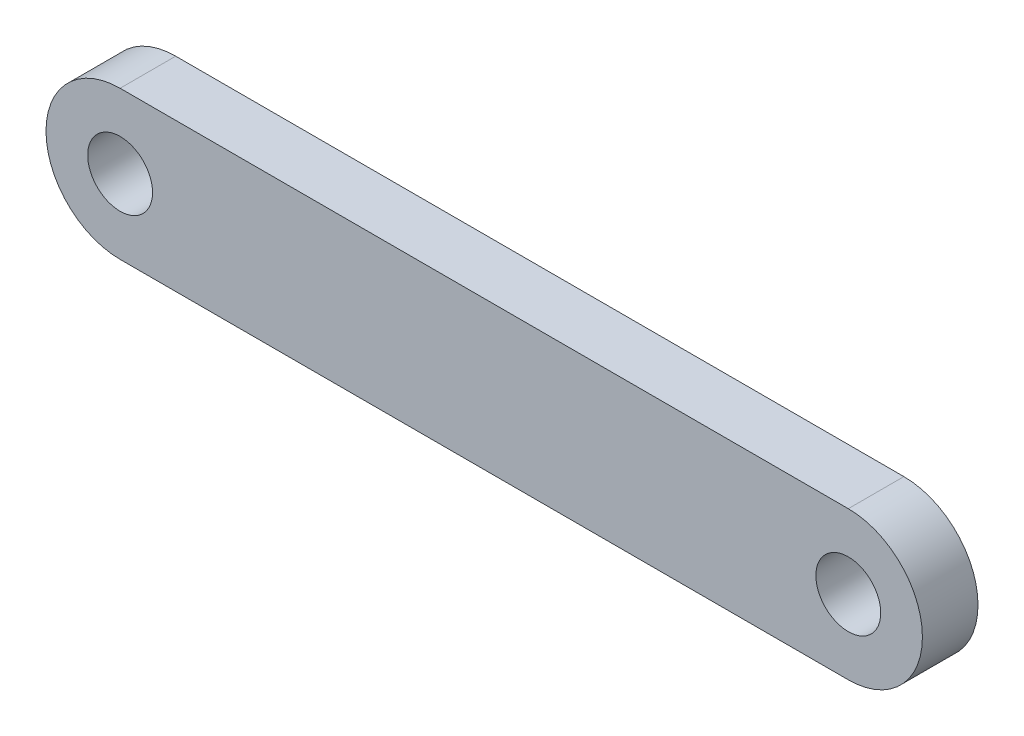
SolidWorks part; units mm, degrees
ref_plane "Plan de face" through (0, 0, 0) normal (0, 0, 1) x (1, 0, 0)
ref_plane "Plan de dessus" through (0, 0, 0) normal (0, 1, 0) x (1, 0, 0)
ref_plane "Plan de droite" through (0, 0, 0) normal (1, 0, 0) x (0, 0, -1)
sketch "Esquisse1" plane through (0, 0, 0) normal (0, 0, 1) x (1, 0, 0)
  line L0 (0, 0) -> (-39.3, 0)
  line L1 (-39.3, 4) -> (0, 4)
  line L2 (-39.3, -4) -> (0, -4)
  circle A0 centre (0, 0) radius 1.75
  arc A1 (0, -4) -> (0, 4) centre (0, 0) ccw
  circle A2 centre (-39.3, 0) radius 1.75
  arc A3 (-39.3, 4) -> (-39.3, -4) centre (-39.3, 0) ccw
  dimension "D1" = 3.5
  dimension "D2" = 8
  dimension "D4" = 3.5
  dimension "D5" = 8
  dimension "D3" = 39.3
extrude "Boss.-Extru.1" add sketch "Esquisse1" along normal blind 3
